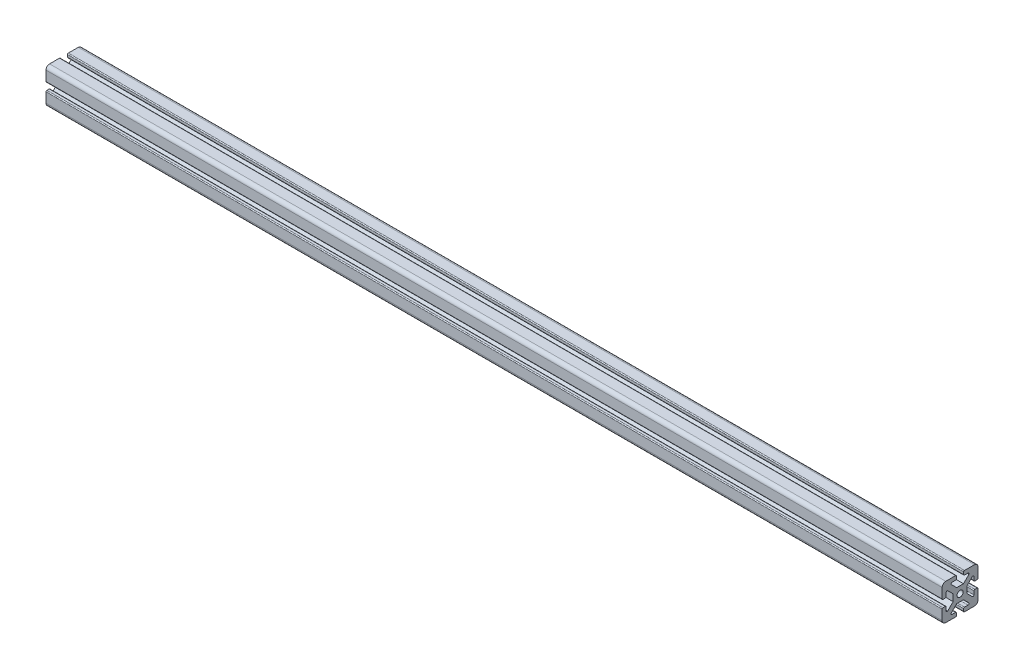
SolidWorks part; units mm, degrees
ref_plane "Ebene vorne" through (0, 0, 0) normal (0, 0, 1) x (1, 0, 0)
ref_plane "Ebene oben" through (0, 0, 0) normal (0, 1, 0) x (1, 0, 0)
ref_plane "Ebene rechts" through (0, 0, 0) normal (1, 0, 0) x (0, 0, -1)
sketch "Skizze1" plane through (0, 0, 0) normal (0, 1, 0) x (1, 0, 0)
  line L0 (0, 0) -> (1000, 0)
  dimension "D1" = 1000
other "Strukturbauteil1"
ref_plane "Ebene1" through (0, 0, 0) normal (1, 0, 0) x (0, 0, -1)
sketch "Model" plane through (0, 0, 0) normal (1, 0, 0) x (0, 0, -1)
  line L0 (-18.5, -4) -> (-16.5, -4)
  line L1 (-15.5, -5) -> (-15.5, -8.9161)
  line L3 (-15.5, 8.9161) -> (-15.5, 5)
  line L4 (-16.5, 4) -> (-18.5, 4)
  line L5 (-20, 5) -> (-20, 16)
  line L6 (-16, 20) -> (-5.5, 20)
  line L7 (-4, 18.5) -> (-4, 16.5)
  line L8 (-5, 15.5) -> (-8.9161, 15.5)
  line L9 (9.7888, 13.7733) -> (3.7935, 7.75)
  line L10 (8.9161, 15.5) -> (5, 15.5)
  line L11 (4, 16.5) -> (4, 18.5)
  line L12 (5.5, 20) -> (16, 20)
  line L13 (20, 16) -> (20, 5.5)
  line L14 (18.5, 4) -> (16.5, 4)
  line L15 (15.5, 5) -> (15.5, 8.9161)
  line L16 (3.7935, 7.75) -> (-3.7935, 7.75)
  line L17 (15.5, -8.9161) -> (15.5, -5)
  line L18 (16.5, -4) -> (18.5, -4)
  line L19 (20, -5.5) -> (20, -16)
  line L20 (16, -20) -> (5.5, -20)
  line L21 (4, -18.5) -> (4, -16.5)
  line L22 (5, -15.5) -> (8.9161, -15.5)
  line L23 (-9.7888, 13.7733) -> (-3.7935, 7.75)
  line L24 (-8.9161, -15.5) -> (-5, -15.5)
  line L25 (-4, -16.5) -> (-4, -18.5)
  line L26 (-5.5, -20) -> (-16, -20)
  line L27 (-20, -16) -> (-20, -5)
  line L28 (-19, 4) -> (-18.5, 4)
  line L29 (-20, -20) -> (20, -20) construction
  line L30 (-20, -20) -> (-20, -4) construction
  line L31 (-20, 20) -> (20, 20) construction
  line L32 (20, -20) -> (20, 20) construction
  line L33 (-20, -20) -> (20, 20) construction
  line L34 (-20, 20) -> (20, -20) construction
  line L35 (-18.5, -4) -> (-19, -4)
  line L36 (-7.75, 3.7935) -> (-7.75, -3.7935)
  line L37 (-5.5, -20) -> (-5, -20)
  line L38 (-4, -19) -> (-4, -18.5)
  line L39 (5.5, -20) -> (5, -20)
  line L40 (4, -19) -> (4, -18.5)
  line L41 (20, -5.5) -> (20, -5)
  line L42 (19, -4) -> (18.5, -4)
  line L43 (18.5, 4) -> (19, 4)
  line L44 (20, 5) -> (20, 5.5)
  line L45 (5.5, 20) -> (5, 20)
  line L46 (4, 19) -> (4, 18.5)
  line L47 (-20, -4) -> (-20, 20) construction
  line L48 (-4, 18.5) -> (-4, 19)
  line L49 (-5, 20) -> (-5.5, 20)
  line L50 (-13.7733, 9.7888) -> (-7.75, 3.7935)
  line L51 (-13.7733, -9.7888) -> (-7.75, -3.7935)
  line L52 (13.7733, -9.7888) -> (7.75, -3.7935)
  line L53 (7.75, -3.7935) -> (7.75, 3.7935)
  line L54 (13.7733, 9.7888) -> (7.75, 3.7935)
  line L55 (-9.7888, -13.7733) -> (-3.7935, -7.75)
  line L56 (-3.7935, -7.75) -> (3.7935, -7.75)
  line L57 (9.7888, -13.7733) -> (3.7935, -7.75)
  circle A0 centre (0, 0) radius 3.4
  arc A1 (-20, 16) -> (-16, 20) centre (-16, 16) cw
  arc A2 (-15.5, -5) -> (-16.5, -4) centre (-16.5, -5) ccw
  arc A3 (-15.5, -8.9161) -> (-13.7733, -9.7888) centre (-14.4161, -8.9161) ccw
  arc A4 (-4, 19) -> (-5, 20) centre (-5, 19) ccw
  arc A5 (5, 20) -> (4, 19) centre (5, 19) ccw
  arc A6 (19, 4) -> (20, 5) centre (19, 5) ccw
  arc A7 (20, -5) -> (19, -4) centre (19, -5) ccw
  arc A8 (-13.7733, 9.7888) -> (-15.5, 8.9161) centre (-14.4161, 8.9161) ccw
  arc A9 (-16.5, 4) -> (-15.5, 5) centre (-16.5, 5) ccw
  arc A10 (5, -20) -> (4, -19) centre (5, -19) cw
  arc A11 (-5, -20) -> (-4, -19) centre (-5, -19) ccw
  arc A12 (-19, -4) -> (-20, -5) centre (-19, -5) ccw
  arc A13 (-5, 15.5) -> (-4, 16.5) centre (-5, 16.5) ccw
  arc A14 (-8.9161, 15.5) -> (-9.7888, 13.7733) centre (-8.9161, 14.4161) ccw
  arc A15 (-19, 4) -> (-20, 5) centre (-19, 5) cw
  arc A19 (9.7888, 13.7733) -> (8.9161, 15.5) centre (8.9161, 14.4161) ccw
  arc A20 (4, 16.5) -> (5, 15.5) centre (5, 16.5) ccw
  arc A22 (20, 16) -> (16, 20) centre (16, 16) ccw
  arc A24 (15.5, 5) -> (16.5, 4) centre (16.5, 5) ccw
  arc A25 (15.5, 8.9161) -> (13.7733, 9.7888) centre (14.4161, 8.9161) ccw
  arc A30 (13.7733, -9.7888) -> (15.5, -8.9161) centre (14.4161, -8.9161) ccw
  arc A31 (16.5, -4) -> (15.5, -5) centre (16.5, -5) ccw
  arc A33 (16, -20) -> (20, -16) centre (16, -16) ccw
  arc A35 (5, -15.5) -> (4, -16.5) centre (5, -16.5) ccw
  arc A36 (8.9161, -15.5) -> (9.7888, -13.7733) centre (8.9161, -14.4161) ccw
  arc A41 (-9.7888, -13.7733) -> (-8.9161, -15.5) centre (-8.9161, -14.4161) ccw
  arc A42 (-4, -16.5) -> (-5, -15.5) centre (-5, -16.5) ccw
  arc A44 (-20, -16) -> (-16, -20) centre (-16, -16) ccw
  point P12 (-4, 20)
  point P46 (0, 0)
  point P47 (4, 20)
  point P68 (20, 4)
  point P72 (20, -4)
  point P76 (4, -20)
  point P97 (-4, -20)
  point P104 (-20, 4)
  point P106 (0, 0)
  point P122 (0, 20)
  point P123 (-20, 0)
  point P124 (0, -20)
  point P125 (20, 0)
  dimension "D1" = 4
  dimension "D3" = 1
  dimension "D2" = 4
